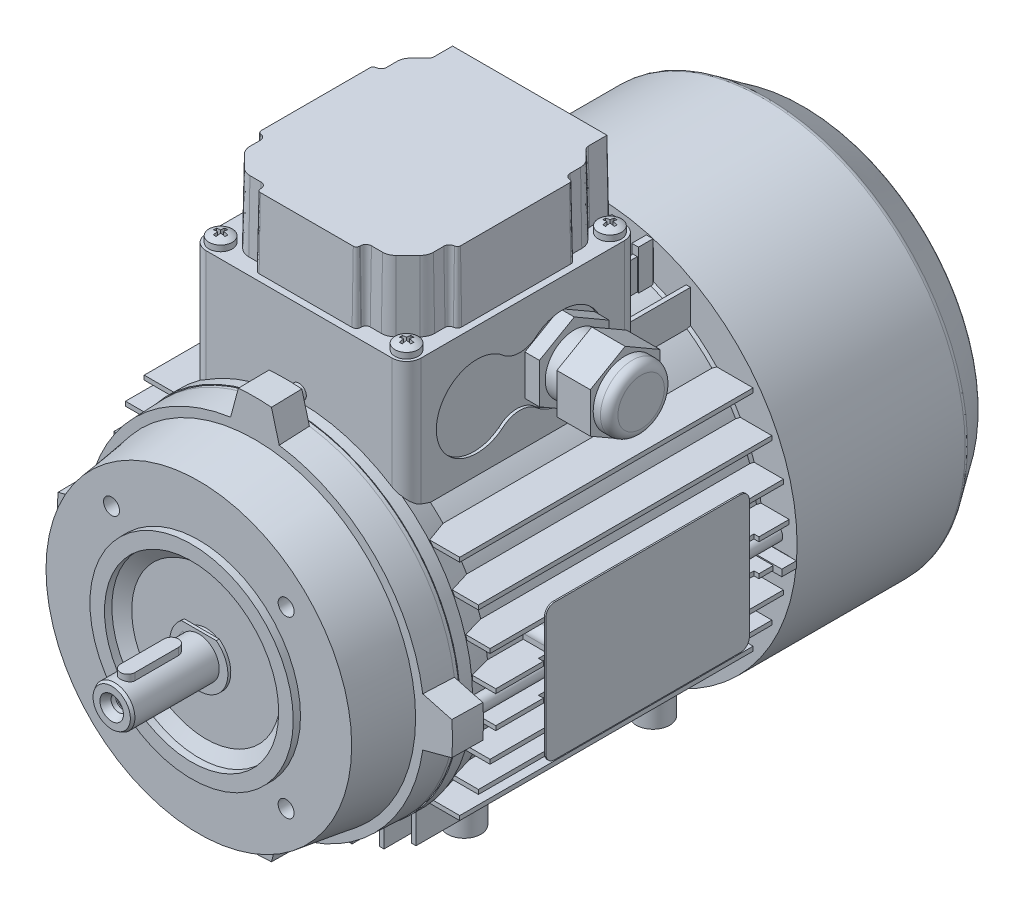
SolidWorks part; units mm, degrees
ref_plane "Front Plane" through (0, 0, 0) normal (0, 0, 1) x (1, 0, 0)
ref_plane "Top Plane" through (0, 0, 0) normal (0, 1, 0) x (1, 0, 0)
ref_plane "Right Plane" through (0, 0, 0) normal (1, 0, 0) x (0, 0, -1)
sketch "Sketch1" plane through (0, 0, 0) normal (0, 0, 1) x (1, 0, 0)
  line L0 (-6, 8) -> (6, 8)
  line L1 (0, 8) -> (0, 0) construction
  line L2 (0, 0) -> (-10, 0) construction
  line L3 (0, 0) -> (-7.0711, 7.0711) construction
  arc A0 (-6, 8) -> (6, 8) centre (0, 0) ccw
  dimension "D4" = 10
  dimension "D1" = 45
  dimension "D2" = 45
  dimension "D3" = 8
extrude "Boss-Extrude1" add sketch "Sketch1" along normal blind 1
imported_body "63" [suppressed]
imported_body "71"
imported_body "56" [suppressed]
imported_body "80" [suppressed]
